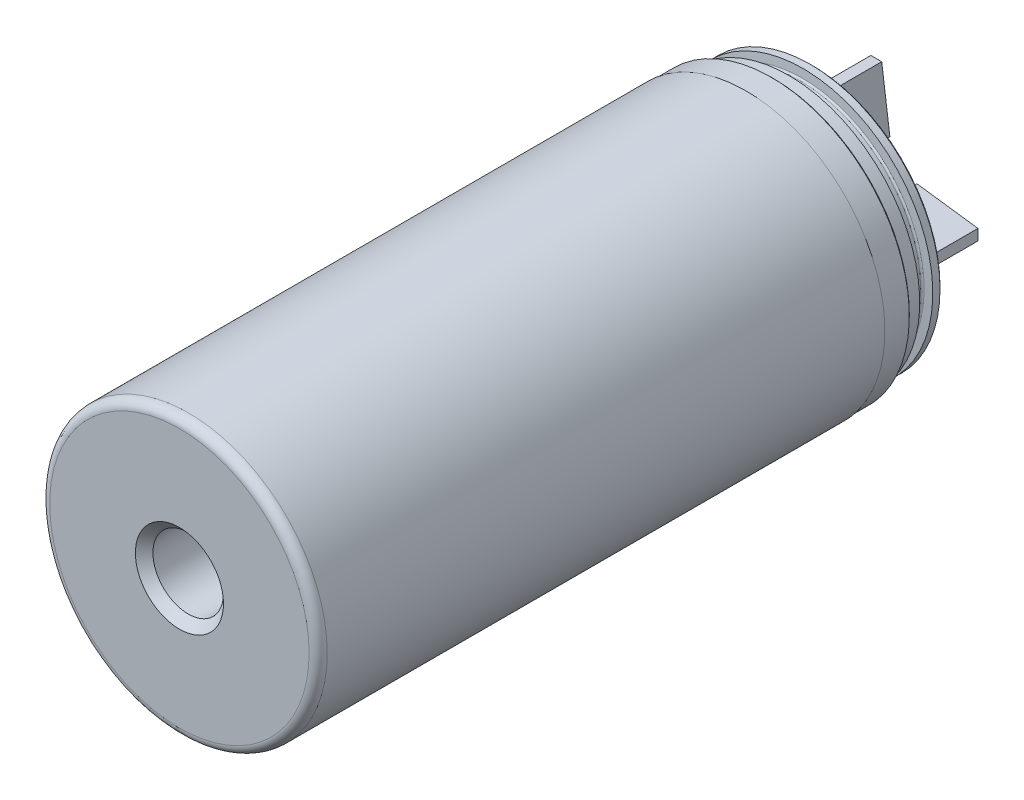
SolidWorks part; units mm, degrees
ref_plane "Front Plane" through (0, 0, 0) normal (0, 0, 1) x (1, 0, 0)
ref_plane "Top Plane" through (0, 0, 0) normal (0, 1, 0) x (1, 0, 0)
ref_plane "Right Plane" through (0, 0, 0) normal (1, 0, 0) x (0, 0, -1)
sketch "Sketch1" plane through (0, 0, 0) normal (0, 0, 1) x (1, 0, 0)
  circle A0 centre (0, 0) radius 19.4945
  dimension "D1" = 38.989
extrude "body" add sketch "Sketch1" along normal blind 88.9
fillet "Fillet1" radius 1.27 1 edges at (19.4945, 0, 88.9)
hole_wizard "7/16-20 Tapped Hole1" positions "Sketch3" profile "Sketch2" tap size "7/16-20" standard "Ansi Inch"
sketch "Sketch3" plane through (0, 0, 88.9) normal (0, 0, 1) x (1, 0, 0)
  point P0 (0, 0)
sketch "Sketch2" plane through (0, 0, 88.9) normal (1, 0, 0) x (0, -1, 0)
  line L0 (0, 0) -> (0, 28.702)
  line L1 (0, 28.702) -> (4.9606, 28.702)
  line L2 (4.9606, 28.702) -> (4.9606, 1.2306)
  line L3 (4.9606, 1.2306) -> (6.1913, 0)
  line L5 (6.1913, 0) -> (0, 0)
  line L6 (-4.9606, 1.2306) -> (-6.1913, 0) construction
  line L10 (0, 28.702) -> (-4.9606, 28.702) construction
  line L11 (0, -6.35) -> (0, 107.95) construction
  dimension "Tap Drill Dia." = 9.9212
  dimension "Tap Drill Depth" = 28.702
  dimension "Near C'Sink Dia." = 12.3825
  dimension "Near C'Sink Angle" = 90
  dimension "Drill Angle" = 180
sketch "Sketch4" plane through (0, 0, 0) normal (0, 0, -1) x (-1, 0, 0)
  circle A0 centre (0, 0) radius 18.415
  circle A1 centre (0, 0) radius 19.4945
  dimension "D1" = 36.83
extrude "oring boss rear" cut sketch "Sketch4" against normal blind 5.461
ref_plane "Plane1" through (0, 0, 5.461) normal (-1, 0, 0) x (0, 1, 0)
sketch "Sketch13" plane through (0, 0, 0) normal (0, 0, -1) x (-1, 0, 0)
  circle A0 centre (0, 0) radius 18.2245
  circle A1 centre (0, 0) radius 18.415 construction
  circle A2 centre (0, 0) radius 18.415
  dimension "D1" = 36.449
extrude "oring boss front" cut sketch "Sketch13" against normal blind 3.302
sketch "Sketch6" plane through (0, 0, 5.461) normal (-1, 0, 0) x (0, 1, 0)
  line L0 (17.0975, 4.0924) -> (18.2245, 4.191)
  line L1 (18.2245, 4.191) -> (18.2245, 2.159)
  line L2 (18.2245, 2.159) -> (17.0975, 2.2576)
  line L3 (16.8656, 2.5106) -> (16.8656, 3.8394)
  line L4 (0, 50) -> (0, -50) construction
  line L5 (18.2245, 5.461) -> (-18.2245, 5.461) construction
  line L6 (18.2245, 2.159) -> (18.2245, 5.461) construction
  arc A0 (17.0975, 2.2576) -> (16.8656, 2.5106) centre (17.1196, 2.5106) cw
  arc A1 (16.8656, 3.8394) -> (17.0975, 4.0924) centre (17.1196, 3.8394) cw
  dimension "D4" = 0.254
  dimension "D5" = 0.254
  dimension "D1" = 1.3589
  dimension "D2" = 265
  dimension "D3" = 265
  dimension "D6" = 2.032
  dimension "D7" = 1.27
revolve "Groove for AS 568-027, O-Ring1" cut sketch "Sketch6"
sketch "Sketch7" plane through (0, 0, 5.461) normal (0, 0, -1) x (-1, 0, 0)
  circle A0 centre (0, 0) radius 19.4945
  circle A1 centre (0, 0) radius 19.3675
  dimension "D1" = 38.735
extrude "1-1/2-18 thread" cut sketch "Sketch7" against normal blind 3.81
chamfer "Chamfer1" distance 0.254 angle 45 1 edges at (-19.3675, 0, 5.461)
ref_axis "Axis1" through (0, 0, -20.6011) along (0, 0, 1)
sketch "Sketch10" plane through (0, 0, 0) normal (0, 0, -1) x (-1, 0, 0)
  circle A0 centre (0, 0) radius 1.397
  dimension "D1" = 2.794
extrude "pump shaft" add sketch "Sketch10" along normal blind 10.668
chamfer "Chamfer2" distance 0.254 angle 45 1 edges at (-1.397, 0, -10.668)
sketch "Sketch11" plane through (0, 0, 0) normal (1, 0, 0) x (0, 0, -1)
  line L0 (20.6011, 0) -> (-93.345, 0) construction
  line L1 (0.508, 0) -> (7.62, 0)
  line L2 (0.508, 0) -> (0.508, 6.096)
  line L3 (0.508, 6.096) -> (3.302, 6.096)
  line L4 (3.302, 6.096) -> (4.445, 4.7625)
  line L6 (4.445, 4.7625) -> (7.62, 4.7625)
  line L7 (7.62, 4.7625) -> (7.62, 0)
  line L8 (0, -18.2245) -> (0, 18.2245) construction
  dimension "D1" = 7.112
  dimension "D2" = 6.096
  dimension "D3" = 2.794
  dimension "D4" = 3.937
  dimension "D5" = 0.508
  dimension "D6" = 4.7625
revolve "hub" add sketch "Sketch11" angle 360 about axis through (0, 0, -20.6011) along (0, 0, 1)
sketch "Sketch12" plane through (0, 0, 0) normal (1, 0, 0) x (0, 0, -1)
  line L0 (0.508, 0) -> (0.508, 14.2875)
  line L1 (20.6011, 0) -> (-93.345, 0) construction
  line L2 (0.508, 14.2875) -> (9.017, 14.2875)
  line L3 (9.017, 14.2875) -> (10.16, 4.572)
  line L4 (10.16, 4.572) -> (7.62, 4.572)
  line L5 (7.62, -4.7625) -> (7.62, 4.7625) construction
  line L6 (7.62, 4.572) -> (7.62, 0)
  line L7 (7.62, 0) -> (0.508, 0)
  line L9 (0.508, 6.096) -> (0.508, -6.096) construction
  dimension "D1" = 14.2875
  dimension "D2" = 4.572
  dimension "D3" = 9.652
  dimension "D4" = 8.509
extrude "impeller" add sketch "Sketch12" along normal mid plane 1.524
pattern_circular "CirPattern3" count 4 every 90 about axis through (0, 0, 0) along (0, 0, 1) of "impeller"
chamfer "Chamfer3" distance 0.254 angle 45 1 edges at (-18.2245, 0, 0)
